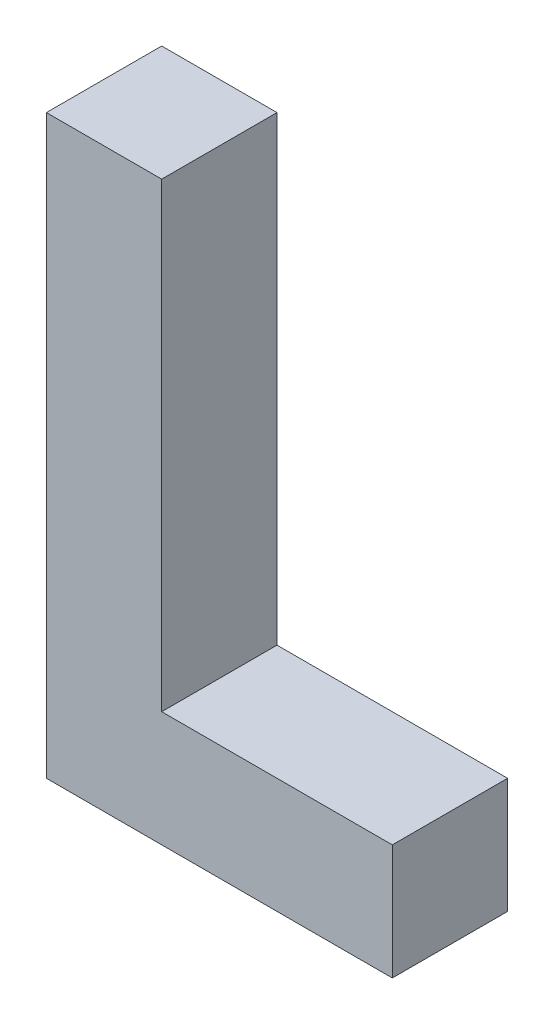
SolidWorks part; units mm, degrees
ref_plane "Plan de face" through (0, 0, 0) normal (0, 0, 1) x (1, 0, 0)
ref_plane "Plan de dessus" through (0, 0, 0) normal (0, 1, 0) x (1, 0, 0)
ref_plane "Plan de droite" through (0, 0, 0) normal (1, 0, 0) x (0, 0, -1)
sketch "Esquisse1" plane through (0, 0, 0) normal (0, 0, 1) x (1, 0, 0)
  line L1 (0, 0) -> (30, 0)
  line L2 (0, 0) -> (0, 10)
  line L3 (10, 10) -> (30, 10)
  line L4 (30, 0) -> (30, 10)
  line L6 (0, 10) -> (0, 50)
  line L7 (0, 50) -> (10, 50)
  line L8 (10, 10) -> (10, 50)
  dimension "D1" = 30
  dimension "D2" = 10
  dimension "D3" = 10
  dimension "D4" = 40
extrude "Boss.-Extru.1" add sketch "Esquisse1" along normal blind 10
